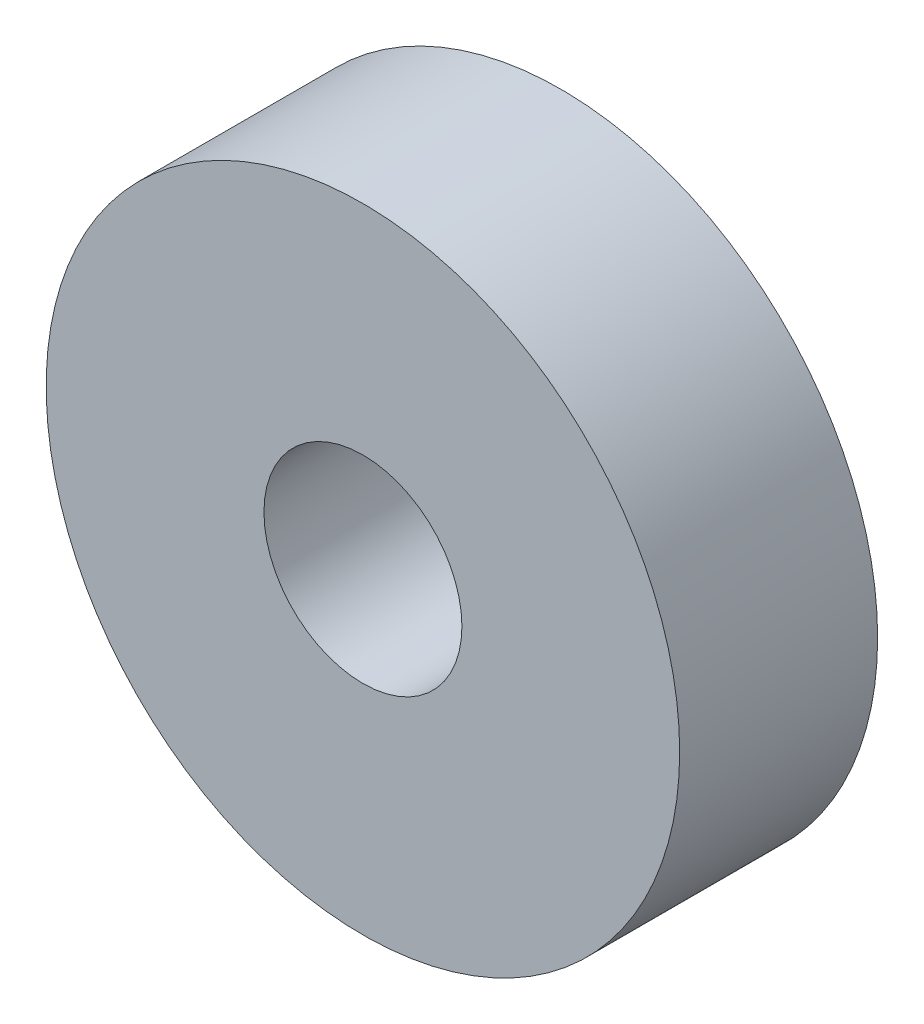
SolidWorks part; units mm, degrees
ref_plane "Alzado" through (0, 0, 0) normal (0, 0, 1) x (1, 0, 0)
ref_plane "Planta" through (0, 0, 0) normal (0, 1, 0) x (1, 0, 0)
ref_plane "Vista lateral" through (0, 0, 0) normal (1, 0, 0) x (0, 0, -1)
sketch "Croquis1" plane through (0, 0, 0) normal (0, 0, 1) x (1, 0, 0)
  circle A0 centre (0, 0) radius 8
  circle A1 centre (0, 0) radius 2.5
  dimension "D1" = 5
  dimension "D2" = 16
extrude "Saliente-Extruir1" add sketch "Croquis1" along normal blind 5
